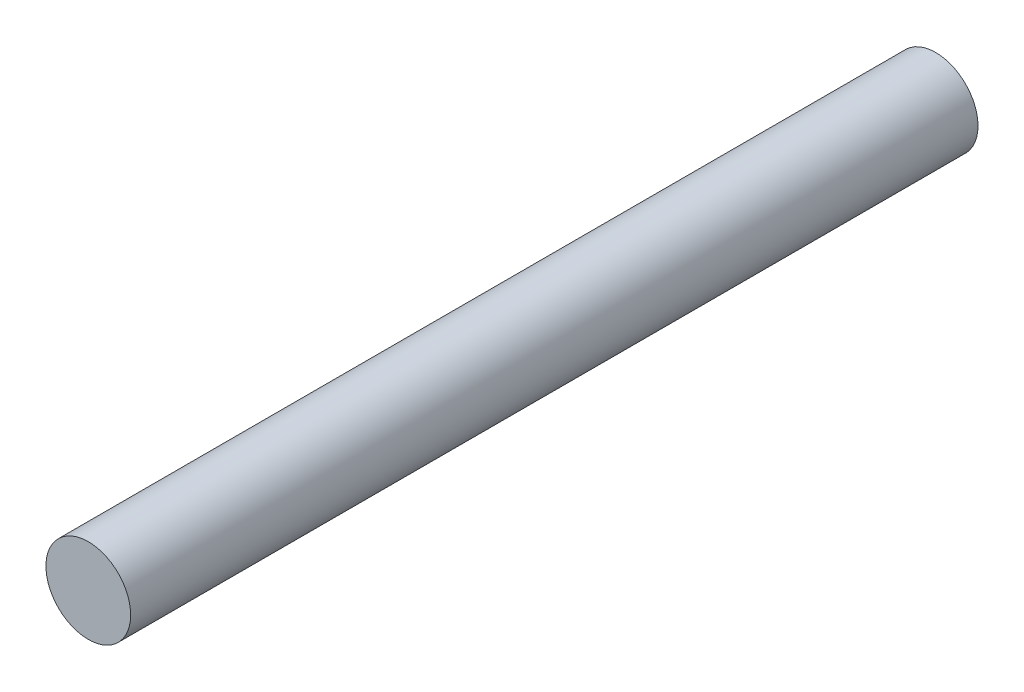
SolidWorks part; units mm, degrees
ref_plane "前视基准面" through (0, 0, 0) normal (0, 0, 1) x (1, 0, 0)
ref_plane "上视基准面" through (0, 0, 0) normal (0, 1, 0) x (1, 0, 0)
ref_plane "右视基准面" through (0, 0, 0) normal (1, 0, 0) x (0, 0, -1)
sketch "草图1" plane through (0, 0, 0) normal (0, 0, 1) x (1, 0, 0)
  circle A0 centre (-1.2942, 0) radius 25
  dimension "D1" = 50
extrude "凸台-拉伸1" add sketch "草图1" along normal blind 500
